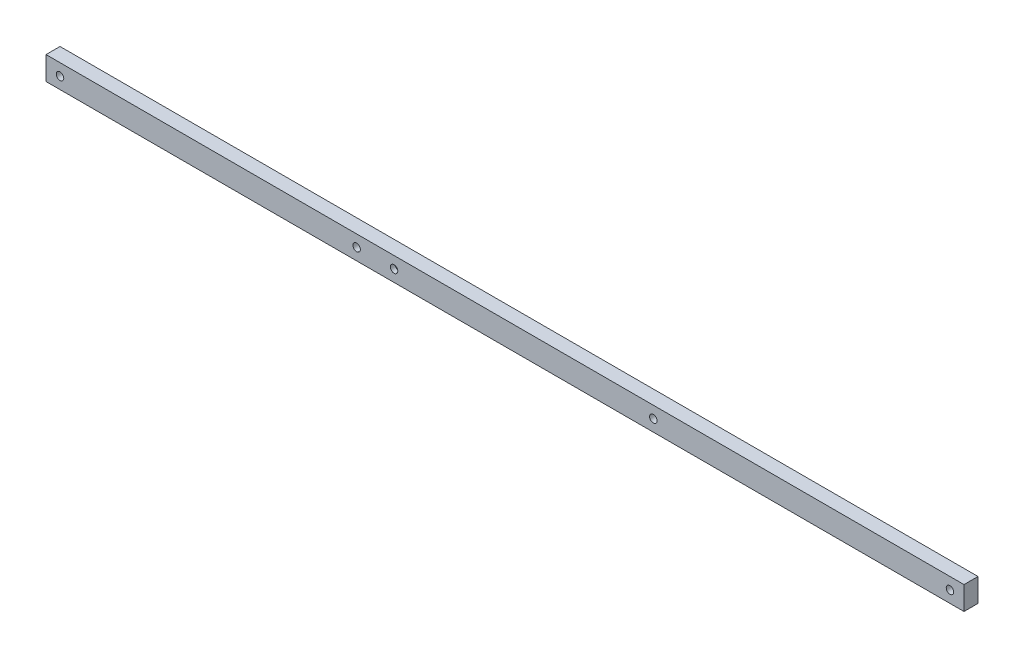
SolidWorks part; units mm, degrees
ref_plane "Plan de face" through (0, 0, 0) normal (0, 0, 1) x (1, 0, 0)
ref_plane "Plan de dessus" through (0, 0, 0) normal (0, 1, 0) x (1, 0, 0)
ref_plane "Plan de droite" through (0, 0, 0) normal (1, 0, 0) x (0, 0, -1)
sketch "Esquisse1" plane through (0, 0, 0) normal (0, 0, 1) x (1, 0, 0)
  line L1 (0, 0) -> (393, 0)
  line L2 (0, 0) -> (0, 10)
  line L3 (0, 10) -> (393, 10)
  line L4 (393, 0) -> (393, 10)
  line L6 (6, -5.3147) -> (6, 36.6425) construction
  line L7 (6, 5) -> (418.2031, 5) construction
  line L10 (393, -36.0722) -> (393, 101.1749) construction
  line L12 (303.9608, 0) -> (-25.6507, 0) construction
  line L13 (569.7795, 10) -> (-25.6507, 10) construction
  circle A0 centre (6, 5) radius 1.6
  circle A1 centre (133, 5) radius 1.6
  circle A2 centre (260, 5) radius 1.6
  circle A3 centre (387, 5) radius 1.6
extrude "Extrusion1" add sketch "Esquisse1" along normal blind 6
sketch "Esquisse2" plane through (0, 0, 6) normal (0, 0, 1) x (1, 0, 0)
  line L0 (-9.0891, 5) -> (400.614, 5) construction
  line L1 (149, 17.809) -> (149, -13.1677) construction
  circle A0 centre (149, 5) radius 1.6
extrude "Enlèv. mat.-Extru.1" cut sketch "Esquisse2" against normal blind 2
